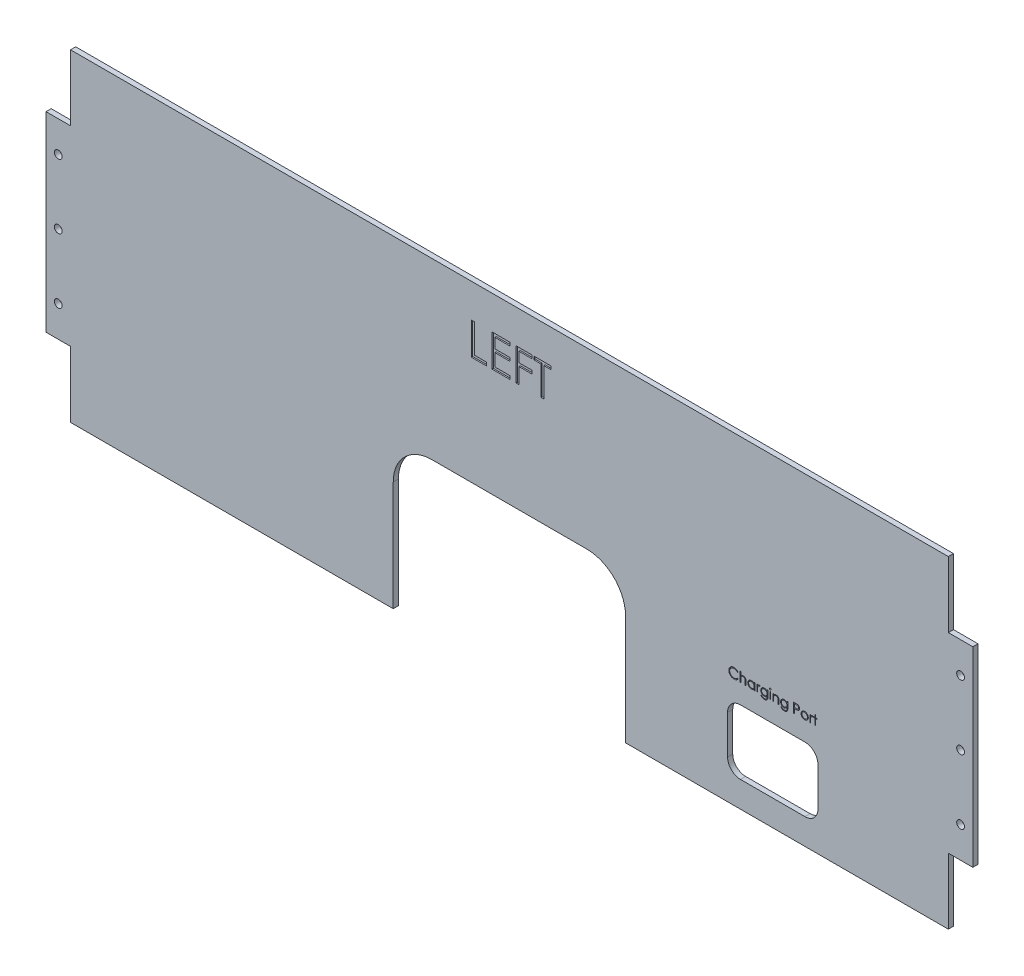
SolidWorks part; units mm, degrees
ref_plane "Plan de face" through (0, 0, 0) normal (0, 0, 1) x (1, 0, 0)
ref_plane "Plan de dessus" through (0, 0, 0) normal (0, 1, 0) x (1, 0, 0)
ref_plane "Plan de droite" through (0, 0, 0) normal (1, 0, 0) x (0, 0, -1)
sketch "Esquisse1" plane through (0, 0, 0) normal (0, 0, 1) x (1, 0, 0)
  line L0 (0, -125) -> (0, 125) construction
  line L1 (340, 125) -> (-340, 125)
  line L2 (-340, 125) -> (-340, 74)
  line L3 (-340, 74) -> (-359, 74)
  line L4 (-359, 74) -> (-359, -74)
  line L5 (-359, -74) -> (-340, -74)
  line L6 (-340, -74) -> (-340, -125)
  line L7 (-340, -125) -> (340, -125)
  line L8 (340, -74) -> (340, -125)
  line L9 (359, -74) -> (340, -74)
  line L10 (359, 74) -> (359, -74)
  line L11 (340, 74) -> (359, 74)
  line L12 (340, 125) -> (340, 74)
  point P4 (0, 0)
  point P7 (-359, 0)
  dimension "D1" = 250
  dimension "D2" = 19
  dimension "D3" = 148
  dimension "D4" = 340
extrude "Boss.-Extru.1" add sketch "Esquisse1" along normal blind 4
sketch "Esquisse2" plane through (0, 0, 4) normal (0, 0, 1) x (1, 0, 0)
  line L0 (-349.5, 74) -> (-349.5, -74) construction
  line L1 (-340, 74) -> (-359, 74) construction
  line L2 (-359, -74) -> (-340, -74) construction
  line L3 (0, 125) -> (0, -125) construction
  line L4 (340, 125) -> (-340, 125) construction
  line L5 (-340, -125) -> (340, -125) construction
  line L6 (349.5, 74) -> (349.5, -74) construction
  circle A0 centre (-349.5, 50) radius 3
  circle A1 centre (-349.5, -50) radius 3
  circle A2 centre (-349.5, 0) radius 3
  circle A3 centre (349.5, 0) radius 3
  circle A4 centre (349.5, -50) radius 3
  circle A5 centre (349.5, 50) radius 3
  dimension "D1" = 6
  dimension "D2" = 50
  dimension "D3" = 50
extrude "Enlèv. mat.-Extru.1" cut sketch "Esquisse2" against normal through all
sketch "Esquisse3" plane through (0, 0, 4) normal (0, 0, 1) x (1, 0, 0)
  line L0 (-340, -125) -> (340, -125) construction
  line L1 (-90, -125) -> (90, -125)
  line L2 (-90, -125) -> (-90, -10)
  line L3 (-90, -10) -> (90, -10)
  line L4 (90, -125) -> (90, -10)
  point P6 (0, -10)
  dimension "D1" = 180
  dimension "D2" = 115
extrude "Enlèv. mat.-Extru.2" cut sketch "Esquisse3" against normal through all
fillet "Congé1" radius 30 2 edges at (90, -10, 2) (-90, -10, 2)
sketch "Esquisse4" plane through (0, 0, 4) normal (0, 0, 1) x (1, 0, 0)
  line L0 (-359, 74) -> (359, 74) construction
  text T0 "LEFT" font "Century Gothic" height 25
extrude "Enlèv. mat.-Extru.3" cut sketch "Esquisse4" against normal blind 1
sketch "Esquisse5" plane through (0, 0, 4) normal (0, 0, 1) x (1, 0, 0)
  line L0 (359, -74) -> (359, 74) construction
  line L1 (229, -55) -> (179, -55)
  line L2 (239, -65) -> (239, -95)
  line L3 (229, -105) -> (179, -105)
  line L4 (169, -65) -> (169, -95)
  line L5 (90, -125) -> (340, -125) construction
  arc A0 (179, -55) -> (169, -65) centre (179, -65) ccw
  arc A1 (179, -105) -> (169, -95) centre (179, -95) cw
  arc A2 (239, -95) -> (229, -105) centre (229, -95) cw
  arc A3 (229, -55) -> (239, -65) centre (229, -65) cw
  point P10 (169, -55)
  point P13 (169, -105)
  point P18 (239, -55)
  dimension "D5" = 10
  dimension "D1" = 70
  dimension "D2" = 50
  dimension "D3" = 120
  dimension "D4" = 20
extrude "Enlèv. mat.-Extru.4" cut sketch "Esquisse5" against normal up to next
sketch "Esquisse6" plane through (0, 0, 4) normal (0, 0, 1) x (1, 0, 0)
  line L0 (169, -65) -> (169, -40) construction
  line L3 (340, -74) -> (359, -74) construction
  line L4 (169, -65) -> (169, -95) construction
  line L5 (169, -40) -> (239, -40) construction
  line L6 (239, -40) -> (239, -65) construction
  line L7 (229, -55) -> (179, -55) construction
  arc A1 (179, -55) -> (169, -65) centre (179, -65) ccw construction
  text T0 "Charging Port" font "Century Gothic" height in points 28
  point P13 (349.5, -74)
  dimension "D1" = 15
extrude "Enlèv. mat.-Extru.5" cut sketch "Esquisse6" against normal blind 1
